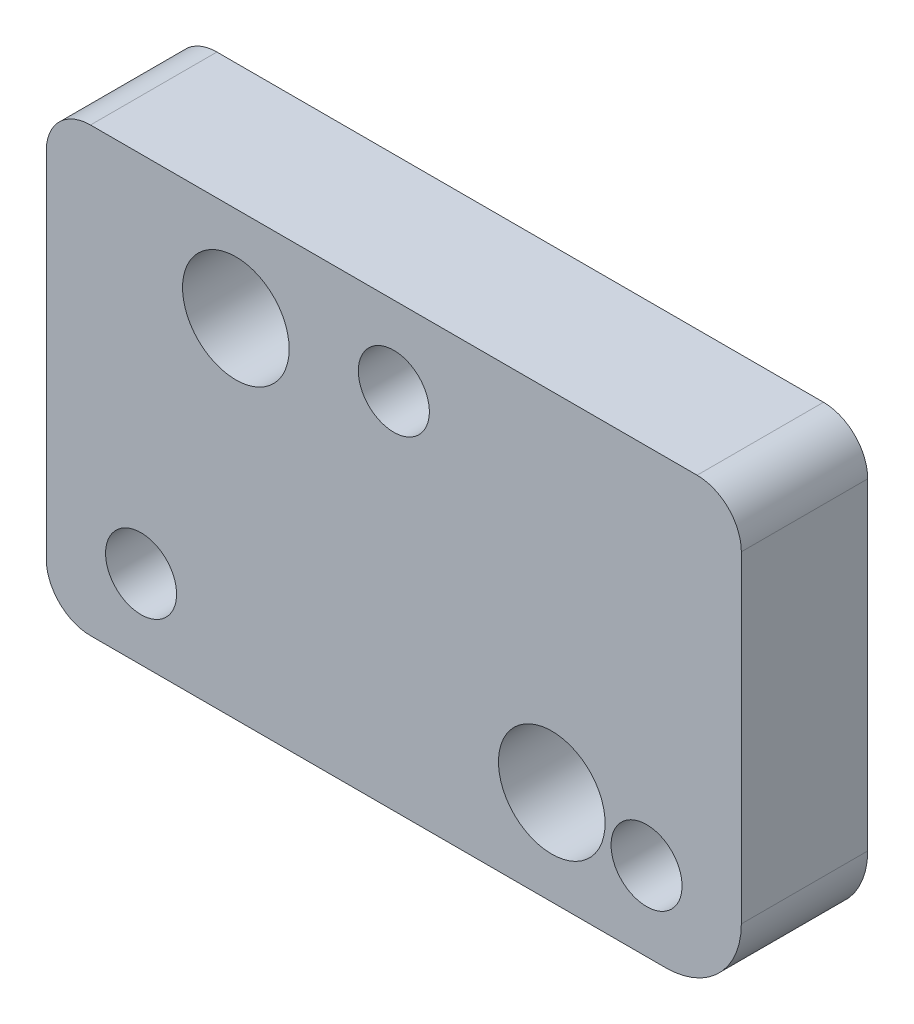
SolidWorks part; units mm, degrees
ref_plane "Front" through (0, 0, 0) normal (0, 0, 1) x (1, 0, 0)
ref_plane "Top" through (0, 0, 0) normal (0, 1, 0) x (1, 0, 0)
ref_plane "Right" through (0, 0, 0) normal (1, 0, 0) x (0, 0, -1)
ref_plane "Plane1"
sketch "Sketch1" plane through (0, 0, 71.9582) normal (0, 0, -1) x (-1, 0, 0)
  line L8 (840.2633, -53.1754) -> (898.0483, -53.1754)
  line L9 (902.4933, -48.7304) -> (902.4933, -13.1704)
  line L10 (898.0483, -8.7254) -> (837.0883, -8.7254)
  line L11 (832.6433, -13.1704) -> (832.6433, -45.5554)
  line L12 (840.2633, -53.1754) -> (898.0483, -53.1754)
  line L13 (902.4933, -48.7304) -> (902.4933, -13.1704)
  line L14 (898.0483, -8.7254) -> (837.0883, -8.7254)
  line L15 (832.6433, -13.1704) -> (832.6433, -45.5554)
  arc A8 (832.6433, -45.5554) -> (840.2633, -53.1754) centre (840.2633, -45.5554) ccw
  arc A9 (898.0483, -53.1754) -> (902.4933, -48.7304) centre (898.0483, -48.7304) ccw
  arc A10 (902.4933, -13.1704) -> (898.0483, -8.7254) centre (898.0483, -13.1704) ccw
  arc A11 (837.0883, -8.7254) -> (832.6433, -13.1704) centre (837.0883, -13.1704) ccw
  arc A12 (832.6433, -45.5554) -> (840.2633, -53.1754) centre (840.2633, -45.5554) ccw
  arc A13 (898.0483, -53.1754) -> (902.4933, -48.7304) centre (898.0483, -48.7304) ccw
  arc A14 (902.4933, -13.1704) -> (898.0483, -8.7254) centre (898.0483, -13.1704) ccw
  arc A15 (837.0883, -8.7254) -> (832.6433, -13.1704) centre (837.0883, -13.1704) ccw
extrude "Boss-Extrude1" add sketch "Sketch1" against normal blind 12.7 flip side to cut
hole_wizard "Hole1" positions "Point_Sketch" profile "Profil_Sketch" hole size "Ø0.15" standard "ISO"
sketch "Point_Sketch" plane through (-876.6775, -20.3493, 71.9582) normal (0, 0, 1) x (-1, 0, 0)
  point P0 (3.6543, 10.6011)
sketch "Profil_Sketch" plane through (-880.3318, -30.9504, 71.9582) normal (1, 0, 0) x (0, 1, 0)
  line L0 (0, 0) -> (0, 10.16)
  line L1 (0, 10.16) -> (0.0005, 10.16)
  line L2 (0.0005, 10.16) -> (0.0005, 0)
  line L5 (0.0005, 0) -> (0, 0)
  line L11 (0, -6.35) -> (0, 107.95) construction
  dimension "Diameter" = 0.001
  dimension "Thru Hole Depth" = 10.16
other "usin_Temp_Suppressed<1>"
hole_wizard "Hole11" positions "Point_Sketch1" profile "Profil_Sketch1" hole size "Ø0.15" standard "ISO"
sketch "Point_Sketch1" plane through (-836.9265, -20.3493, 71.9582) normal (0, 0, 1) x (-1, 0, 0)
  point P0 (3.6543, 10.6011)
sketch "Profil_Sketch1" plane through (-840.5808, -30.9504, 71.9582) normal (1, 0, 0) x (0, 1, 0)
  line L0 (0, 0) -> (0, 10.16)
  line L1 (0, 10.16) -> (0.0005, 10.16)
  line L2 (0.0005, 10.16) -> (0.0005, 0)
  line L5 (0.0005, 0) -> (0, 0)
  line L11 (0, -6.35) -> (0, 107.95) construction
  dimension "Diameter" = 0.001
  dimension "Thru Hole Depth" = 10.16
other "usin_Temp_Suppressed<2>"
hole_wizard "Hole12" positions "Point_Sketch2" profile "Profil_Sketch2" hole size "Ø0.15" standard "ISO"
sketch "Point_Sketch2" plane through (-838.514, -34.6368, 71.9582) normal (0, 0, 1) x (-1, 0, 0)
  point P0 (3.6543, 10.6011)
  point P2 (54.4543, 10.6011)
  point P4 (29.0543, -17.9739)
sketch "Profil_Sketch2" plane through (-842.1683, -45.2379, 71.9582) normal (1, 0, 0) x (0, 1, 0)
  line L0 (0, 0) -> (0, 12.7)
  line L1 (0, 12.7) -> (3.5687, 12.7)
  line L2 (3.5687, 12.7) -> (3.5687, 0)
  line L5 (3.5687, 0) -> (0, 0)
  line L11 (0, -6.35) -> (0, 107.95) construction
  dimension "Diameter" = 7.1374
  dimension "Thru Hole Depth" = 12.7
other "usin_DL090_.25-20x1.75-SHCS<1>"
hole_wizard "Hole13" positions "Point_Sketch3" profile "Profil_Sketch3" counterbore size "1/4" standard "ANSI Inch"
sketch "Point_Sketch3" plane through (-864.5624, -42.7154, 84.6582) normal (0, 0, -1) x (1, 0, 0)
  point P0 (12.8691, 0.935)
  point P2 (-18.8809, -24.465)
sketch "Profil_Sketch3" plane through (-851.6933, -43.6504, 84.6582) normal (1, 0, 0) x (0, -1, 0)
  line L0 (0, 0) -> (0, 12.7)
  line L1 (0, 12.7) -> (3.5687, 12.7)
  line L3 (3.5687, 12.7) -> (3.5687, 7.874)
  line L4 (3.5687, 7.874) -> (5.3594, 7.874)
  line L5 (5.3594, 7.874) -> (5.3594, 0)
  line L7 (5.3594, 0) -> (0, 0)
  line L11 (0, -6.35) -> (0, 107.95) construction
  dimension "Diameter" = 7.1374
  dimension "Thru Hole Depth" = 12.7
  dimension "L1" = 7.874
other "usin_LS160_.25-20x.625-SHCS<1>"
